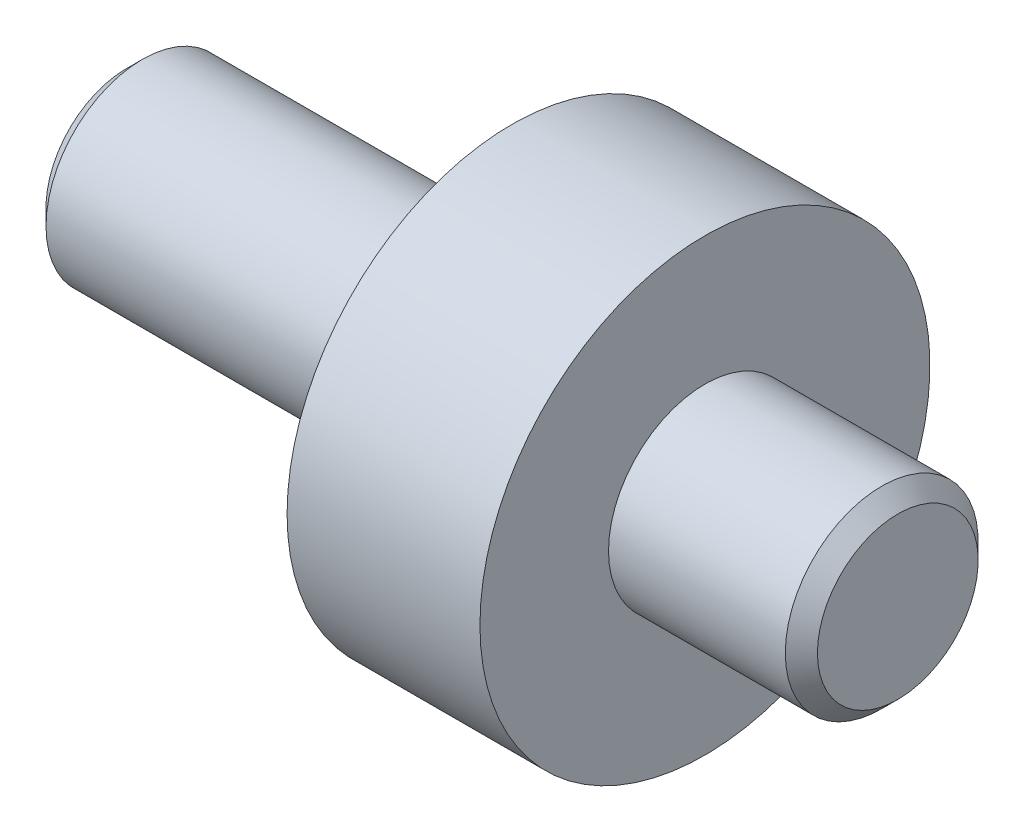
SolidWorks part; units mm, degrees
ref_plane "Face" through (0, 0, 0) normal (0, 0, 1) x (1, 0, 0)
ref_plane "Dessus" through (0, 0, 0) normal (0, 1, 0) x (1, 0, 0)
ref_plane "Droite" through (0, 0, 0) normal (1, 0, 0) x (0, 0, -1)
sketch "Esquisse1" plane through (0, 0, 0) normal (0, 0, 1) x (1, 0, 0)
  line L0 (0, 0) -> (103.4778, 0) construction
  line L1 (0, 0) -> (0, 3)
  line L2 (0, 3) -> (12, 3)
  line L3 (12, 3) -> (12, 7)
  line L4 (12, 7) -> (18, 7)
  line L5 (18, 7) -> (18, 3)
  line L6 (18, 3) -> (24, 3)
  line L7 (24, 3) -> (24, 0)
  line L8 (0, 0) -> (24, 0)
  dimension "D1" = 12
  dimension "D2" = 6
  dimension "D3" = 6
  dimension "D4" = 6
  dimension "D5" = 14
revolve "Base-Révolution" add sketch "Esquisse1" angle 360 about L0
chamfer "Chanfrein1" distance 0.5 angle 45
